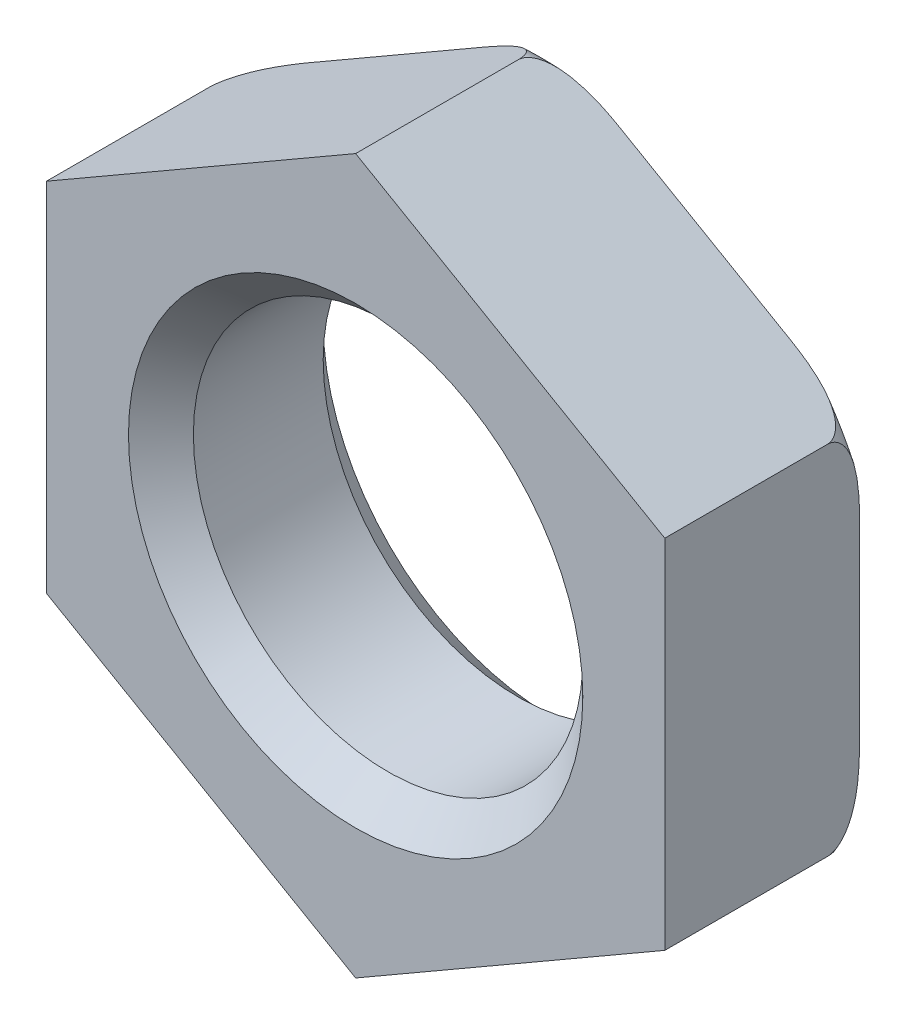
SolidWorks part; units mm, degrees
ref_plane "Plan1" through (0, 0, 0) normal (0, 0, 1) x (1, 0, 0)
ref_plane "Plan2" through (0, 0, 0) normal (0, 1, 0) x (1, 0, 0)
ref_plane "Plan3" through (0, 0, 0) normal (1, 0, 0) x (0, 0, -1)
sketch "Esquisse1" plane through (0, 0, 0) normal (0, 0, 1) x (1, 0, 0)
  line L0 (0, 5.5) -> (4.7631, 2.75)
  line L1 (4.7631, 2.75) -> (4.7631, -2.75)
  line L2 (4.7631, -2.75) -> (0, -5.5)
  line L3 (0, -5.5) -> (-4.7631, -2.75)
  line L4 (-4.7631, -2.75) -> (-4.7631, 2.75)
  line L5 (-4.7631, 2.75) -> (0, 5.5)
  line L6 (0, 5.5) -> (0, -5.5) construction
  circle A0 centre (0, 0) radius 5.5 construction
  circle A1 centre (0, 0) radius 3
  dimension "D1" = 11
  dimension "D2" = 6
extrude "Base-Extrusion" add sketch "Esquisse1" along normal blind 3
chamfer "Chanfrein1" distance 0.5 angle 45 2 edges at (3, 0, 0) (3, 0, 3)
sketch "Esquisse2" plane through (0, 0, 0) normal (1, 0, 0) x (0, 0, -1)
  line L0 (-3, 5.5) -> (0, 5.5) construction
  line L1 (0, 5.5) -> (0, 2.75) construction
  line L2 (0, 5) -> (0.6196, 5)
  line L3 (0.6196, 5) -> (0.6196, 6.0008)
  line L4 (0.6196, 6.0008) -> (-0.5, 6.0008)
  line L5 (-0.5, 6.0008) -> (-0.5, 5.5)
  line L6 (0, 0) -> (-5.9379, 0) construction
  line L7 (-2.5, 0) -> (-0.5, 0) construction
  circle A0 centre (-0.5, 5) radius 0.5 construction
  arc A1 (-0.5, 5.5) -> (0, 5) centre (-0.5, 5) cw
  dimension "D3" = 1
  dimension "D1" = 0.5
  dimension "D2" = 0.5
revolve "Enlèvement de matière-Révolution1" cut sketch "Esquisse2" angle 360 about L6
